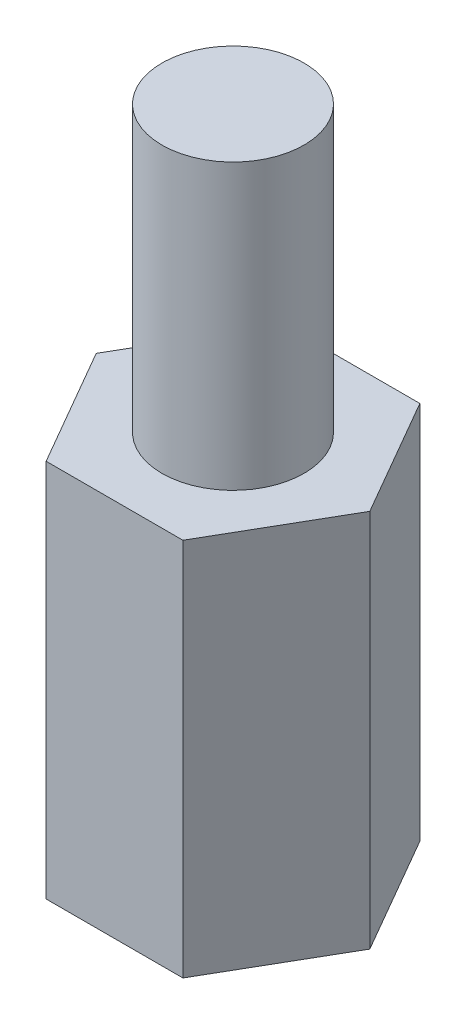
SolidWorks part; units mm, degrees
ref_plane "前视基准面" through (0, 0, 0) normal (0, 0, 1) x (1, 0, 0)
ref_plane "上视基准面" through (0, 0, 0) normal (0, 1, 0) x (1, 0, 0)
ref_plane "右视基准面" through (0, 0, 0) normal (1, 0, 0) x (0, 0, -1)
sketch "草图1" plane through (0, 0, 0) normal (0, 1, 0) x (1, 0, 0)
  line L1 (2.8868, 0) -> (1.4434, 2.5)
  line L2 (1.4434, 2.5) -> (-1.4434, 2.5)
  line L3 (-1.4434, 2.5) -> (-2.8868, 0)
  line L4 (-2.8868, 0) -> (-1.4434, -2.5)
  line L5 (-1.4434, -2.5) -> (1.4434, -2.5)
  line L6 (1.4434, -2.5) -> (2.8868, 0)
  circle A0 centre (0, 0) radius 2.5 construction
  circle A1 centre (0, 0) radius 1.5
  dimension "D1" = 3
  dimension "D2" = 5
extrude "凸台-拉伸1" add sketch "草图1" along normal blind 8
sketch "草图2" plane through (0, 8, 0) normal (0, 1, 0) x (1, 0, 0)
  circle A0 centre (0, 0) radius 1.5 construction
  circle A1 centre (0, 0) radius 1.5
extrude "凸台-拉伸2" add sketch "草图2" along normal blind 6 separate body
